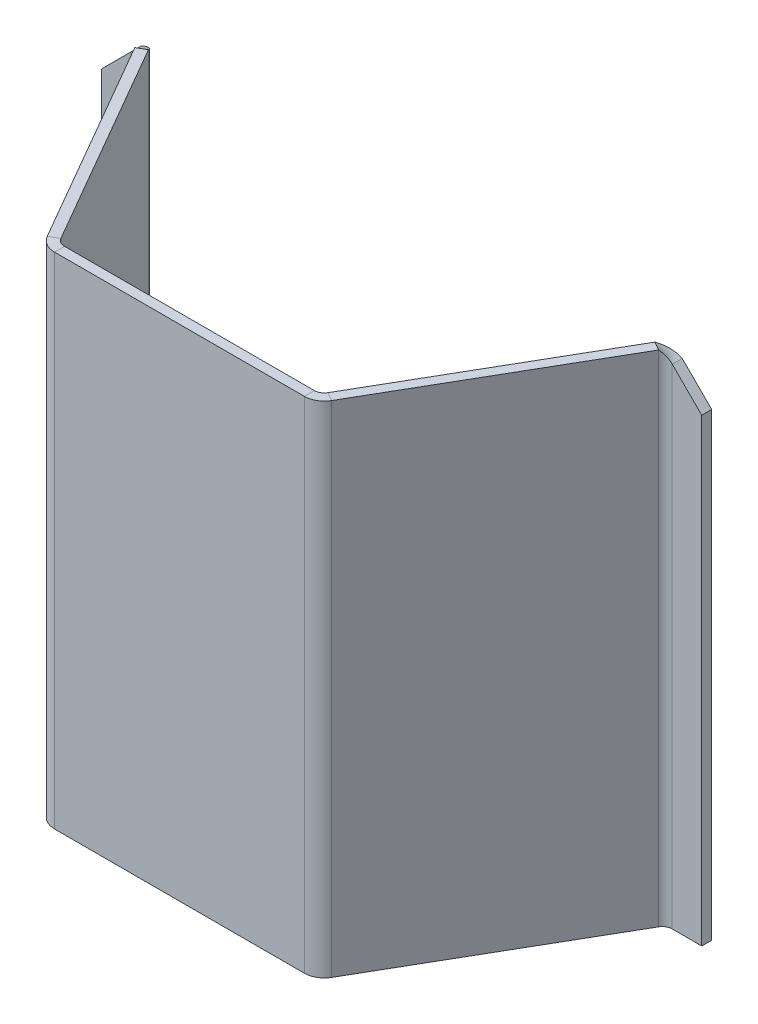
SolidWorks part; units mm, degrees
ref_plane "Front Plane" through (0, 0, 0) normal (0, 0, 1) x (1, 0, 0)
ref_plane "Top Plane" through (0, 0, 0) normal (0, 1, 0) x (1, 0, 0)
ref_plane "Right Plane" through (0, 0, 0) normal (1, 0, 0) x (0, 0, -1)
sketch "Sketch1" plane through (0, 0, 0) normal (0, 0, 1) x (1, 0, 0)
  line L0 (0, 0) -> (83, 0)
  line L1 (83, 0) -> (83, 46)
  line L2 (83, 46) -> (79, 50)
  line L3 (79, 50) -> (4, 50)
  line L4 (4, 50) -> (0, 46)
  line L5 (0, 46) -> (0, 0)
  dimension "D1" = 4
  dimension "D2" = 4
  dimension "D3" = 50
  dimension "D4" = 4
  dimension "D5" = 4
  dimension "D6" = 75
sheet metal parameters "Sheet-Metal1" thickness 1 parameters "D1"=1
base flange "Base-Flange1" sketch "Sketch1" thickness 1 reverse thickness direction yes parameters "D1"=1
sketch "Sketch3" plane through (0, 0, 1) normal (0, 0, 1) x (1, 0, 0)
  line L0 (79, 50) -> (79, 0)
  line L1 (0, 0) -> (83, 0) construction
  line L2 (4, 50) -> (4, 0)
sketched bend "Sketched Bend1" parameters "D1"=0
bend "SketchBend1" bend radius 1 bend angle 60 parameters "D5"=1
bend "SketchBend2" bend radius 0 bend angle 60 parameters "D5"=2
sketch "Sketch4" plane through (0, 0, 1) normal (0, 0, 1) x (1, 0, 0)
  line L0 (41.5, 50) -> (41.5, 0) construction
  line L1 (79, 50) -> (4, 50) construction
  line L2 (4, 0) -> (79, 0) construction
  line L3 (54, 50) -> (54, 0)
  line L4 (29, 50) -> (29, 0)
  dimension "D1" = 12.5
  dimension "D2" = 12.5
sketched bend "Sketched Bend2" parameters "D1"=0
bend "SketchBend3" bend radius 1 bend angle 60 parameters "D5"=3
bend "SketchBend4" bend radius 0 bend angle 60 parameters "D5"=4
flat pattern "Flat-Pattern1"
sketch "Bend-Lines1" plane through (0, 0, 0) normal (0, 1, 0) x (-1, 0, 0)
bend of the flat pattern "Flatten-<SketchBend1>1"
bend of the flat pattern "Flatten-<SketchBend2>1"
bend of the flat pattern "Flatten-<SketchBend3>1"
bend of the flat pattern "Flatten-<SketchBend4>1"
